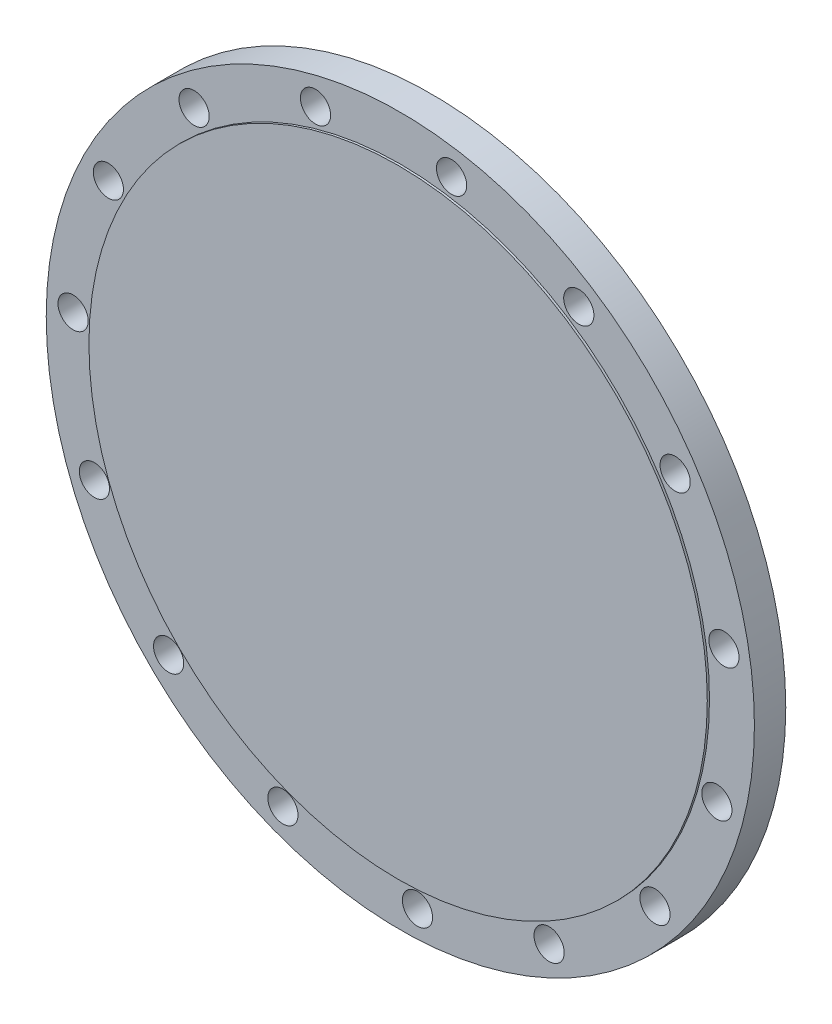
SolidWorks part; units mm, degrees
ref_plane "Front" through (0, 0, 0) normal (0, 0, 1) x (1, 0, 0)
ref_plane "Top" through (0, 0, 0) normal (0, 1, 0) x (1, 0, 0)
ref_plane "Right" through (0, 0, 0) normal (1, 0, 0) x (0, 0, -1)
sketch "Sketch1" plane through (0, 0, 0) normal (0, 0, 1) x (1, 0, 0)
  circle A0 centre (0, 0) radius 335
  dimension "D1" = 670
extrude "Extrude1" add sketch "Sketch1" along normal blind 31.75
sketch "Sketch2" plane through (0, 0, 31.75) normal (0, 0, 1) x (1, 0, 0)
  line L0 (0, 108.4216) -> (0, 0) construction
  line L1 (0, 0) -> (48.4947, 306.1834) construction
  circle A0 centre (0, 0) radius 310 construction
  circle A1 centre (48.4947, 306.1834) radius 14.2875
  dimension "D1" = 620
  dimension "D2" = 28.575
  dimension "D3" = 9
extrude "Cut-Extrude1" cut sketch "Sketch2" against normal through all
pattern_circular "CirPattern1" count 15 over 360 about axis through (0, 0, 0) along (0, 0, 1) of "Cut-Extrude1"
sketch "Sketch12" plane through (0, 0, 31.75) normal (0, 0, 1) x (1, 0, 0)
  circle A0 centre (0, 0) radius 292.5
  dimension "D1" = 585
extrude "Cut-Extrude2" cut sketch "Sketch12" against normal blind 2.0955 flip side to cut
